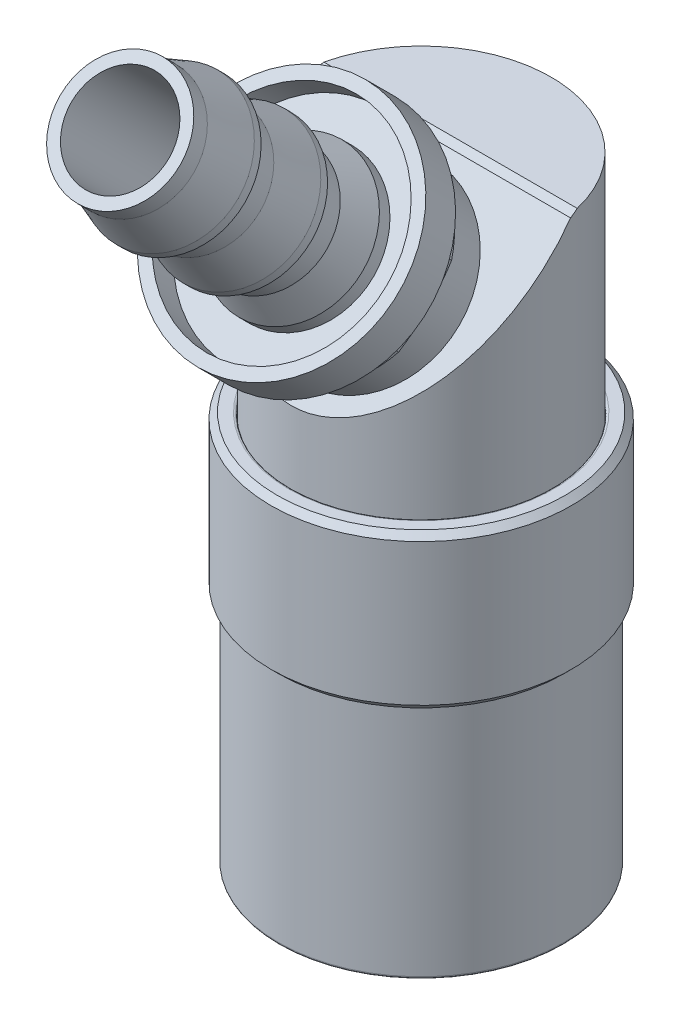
SolidWorks part; units mm, degrees
other "BODY_"
ref_plane "Front Plane" through (0, 0, 0) normal (0, 0, 1) x (1, 0, 0)
ref_plane "Top Plane" through (0, 0, 0) normal (0, 1, 0) x (1, 0, 0)
ref_plane "Right Plane" through (0, 0, 0) normal (1, 0, 0) x (0, 0, -1)
imported_body "SLEEVE"
imported_body "BARB"
imported_body "PL-BARB"
imported_body "SC200S"
imported_body "BODY"
sketch "Sketch1" plane through (0, 0, 0) normal (0, -1, 0) x (1, 0, 0)
  circle A0 centre (0, 0) radius 10.033
  circle A1 centre (0, 0) radius 7.9375
  dimension "D1" = 15.875
extrude "Boss-Extrude1" add sketch "Sketch1" against normal up to surface (17.0688 mm away)
sketch "Sketch2" plane through (0, 0, 0) normal (0, -1, 0) x (1, 0, 0)
  line L1 (-9.652, 5.5726) -> (-9.652, -5.5726)
  line L2 (-9.652, -5.5726) -> (0, -11.1452)
  line L3 (0, -11.1452) -> (9.652, -5.5726)
  line L4 (9.652, -5.5726) -> (9.652, 5.5726)
  line L5 (9.652, 5.5726) -> (0, 11.1452)
  line L6 (0, 11.1452) -> (-9.652, 5.5726)
  circle A0 centre (0, 0) radius 9.652 construction
  dimension "D1" = 19.304
extrude "Cut-Extrude1" cut sketch "Sketch2" against normal up to surface (18.181 mm away)
